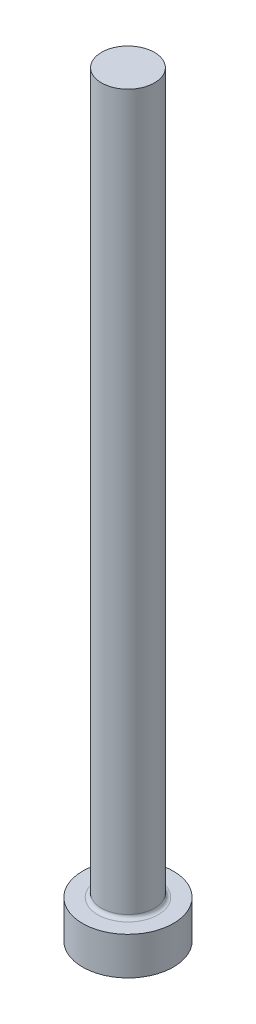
SolidWorks part; units mm, degrees
ref_plane "Plano frontal" through (0, 0, 0) normal (0, 0, 1) x (1, 0, 0)
ref_plane "Plano superior" through (0, 0, 0) normal (0, 1, 0) x (1, 0, 0)
ref_plane "Plano direito" through (0, 0, 0) normal (1, 0, 0) x (0, 0, -1)
sketch "Esboço1" plane through (0, 0, 0) normal (0, 0, 1) x (1, 0, 0)
  line L0 (0, 0) -> (6, 0)
  line L1 (6, 0) -> (6, 5)
  line L2 (6, 5) -> (4, 5)
  line L3 (3.5, 5.5) -> (3.5, 100)
  line L4 (3.5, 100) -> (0, 100)
  line L5 (0, 100) -> (0, 0) construction
  line L6 (0, 0) -> (0, 100)
  arc A0 (4, 5) -> (3.5, 5.5) centre (4, 5.5) cw
  dimension "D3" = 0.5
  dimension "D1" = 12
  dimension "D2" = 7
  dimension "D4" = 5
  dimension "D5" = 100
revolve "Revolução1" add sketch "Esboço1" angle 360 about L5
sketch "Esboço2"
  dimension "D1" = 1.05
  dimension "D2" = 0.675
  dimension "D3" = 3.225
  dimension "D4" = 0.45
wrap "Envolver1" sketch "Esboço2" wrap type deboss source sketch "Esboço2" thickness 0.1 parameters "D1"=0.1
